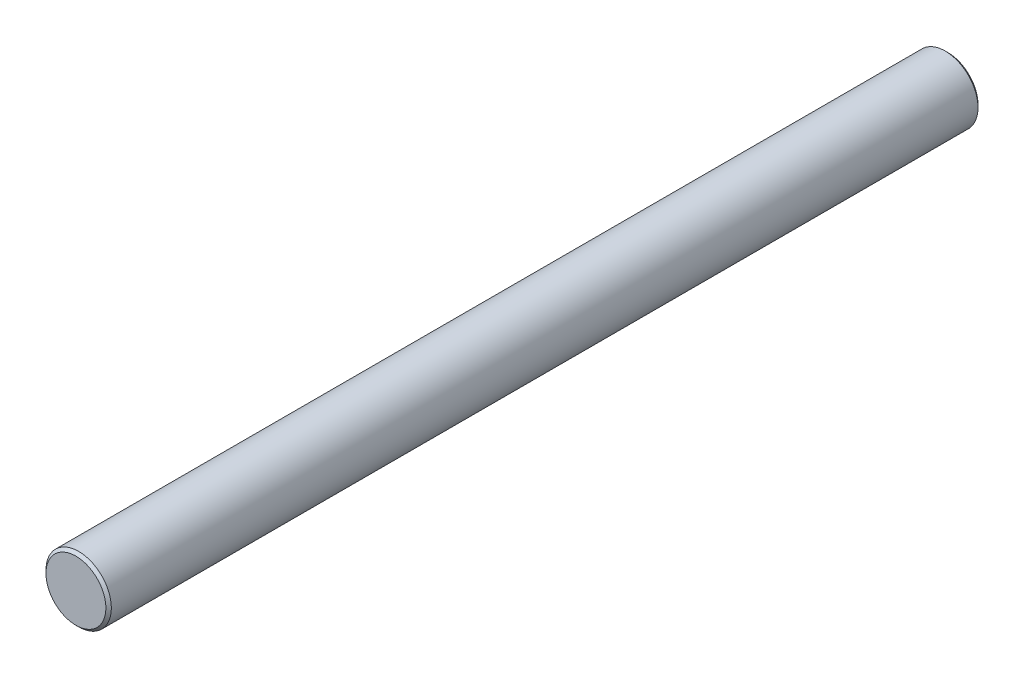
SolidWorks part; units mm, degrees
ref_plane "Спереди" through (0, 0, 0) normal (0, 0, 1) x (1, 0, 0)
ref_plane "Сверху" through (0, 0, 0) normal (0, 1, 0) x (1, 0, 0)
ref_plane "Справа" through (0, 0, 0) normal (1, 0, 0) x (0, 0, -1)
sketch "Эскиз1" plane through (0, 0, 0) normal (0, 0, 1) x (1, 0, 0)
  circle A0 centre (0, 0) radius 3
  dimension "D1" = 6
extrude "Бобышка-Вытянуть1" add sketch "Эскиз1" along normal blind 80
chamfer "Фаска1" distance 0.25 angle 45 2 edges at (3, 0, 0) (3, 0, 80)
